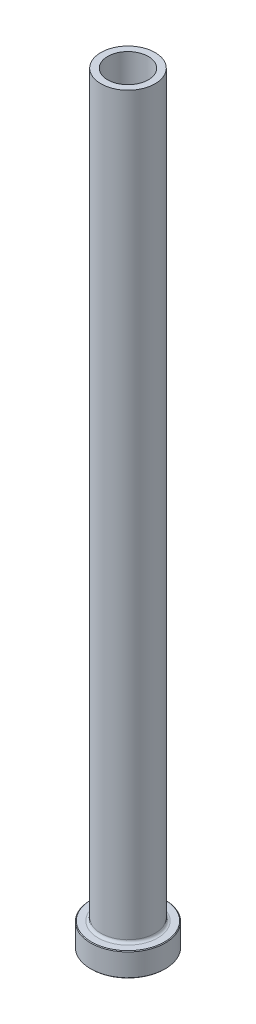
SolidWorks part; units mm, degrees
ref_plane "Front Plane" through (0, 0, 0) normal (0, 0, 1) x (1, 0, 0)
ref_plane "Top Plane" through (0, 0, 0) normal (0, 1, 0) x (1, 0, 0)
ref_plane "Right Plane" through (0, 0, 0) normal (1, 0, 0) x (0, 0, -1)
sketch "Sketch1" plane through (0, 0, 0) normal (0, 0, 1) x (1, 0, 0)
  line L0 (-6, 225) -> (-8, 225)
  line L1 (-8, 225) -> (-8, 7)
  line L2 (-8, 7) -> (-11, 7)
  line L3 (-11, 7) -> (-11, 0)
  line L4 (12.1, 0) -> (-12.1, 0) construction
  line L5 (-11, 0) -> (-6.25, 0)
  line L6 (-6, 170) -> (-6, 225)
  line L7 (0, 92.1877) -> (0, -15.5353) construction
  line L8 (0, -12.1) -> (0, 12.1) construction
  line L9 (-6, 170) -> (-6.25, 158)
  line L10 (-6.25, 158) -> (-6.25, 0)
  dimension "D1" = 0.25
  dimension "ID" = 12
  dimension "OD" = 16
  dimension "L" = 225
  dimension "H" = 22
  dimension "T" = 7
  dimension "N" = 55
  dimension "D2" = 12
revolve "Revolve1" add sketch "Sketch1" angle 360 about L7
fillet "Fillet1" radius 0.8 1 edges at (0, 7, 8)
chamfer "Chamfer1" distance 0.2 angle 45 2 edges at (0, 7, 11) (0, 0, 11)
chamfer "Chamfer3" distance 0.5 angle 45 1 edges at (0, 0, 6.25)
